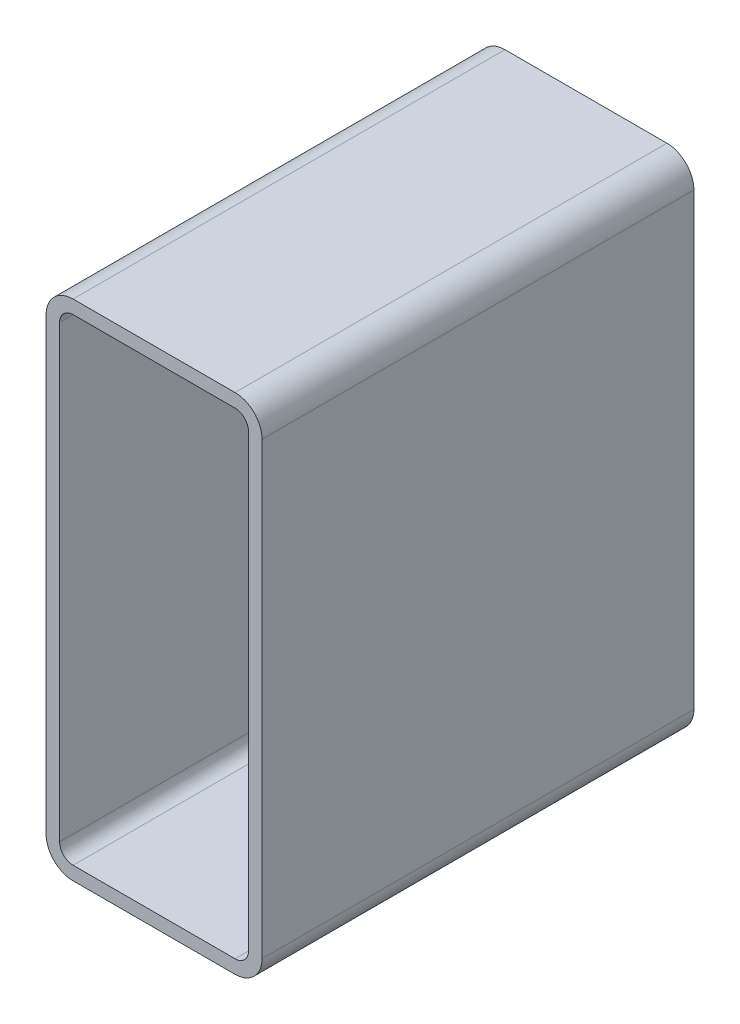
SolidWorks part; units mm, degrees
ref_plane "Front Plane" through (0, 0, 0) normal (0, 0, 1) x (1, 0, 0)
ref_plane "Top Plane" through (0, 0, 0) normal (0, 1, 0) x (1, 0, 0)
ref_plane "Right Plane" through (0, 0, 0) normal (1, 0, 0) x (0, 0, -1)
sketch "Sketch1" plane through (0, 0, 0) normal (0, 0, 1) x (1, 0, 0)
sketch_block_instance "HSS14x6x0.375-1"
sketch_block "HSS14x6x0.375"
extrude "Boss-Extrude1" add sketch "Sketch1" along normal blind 304.8
